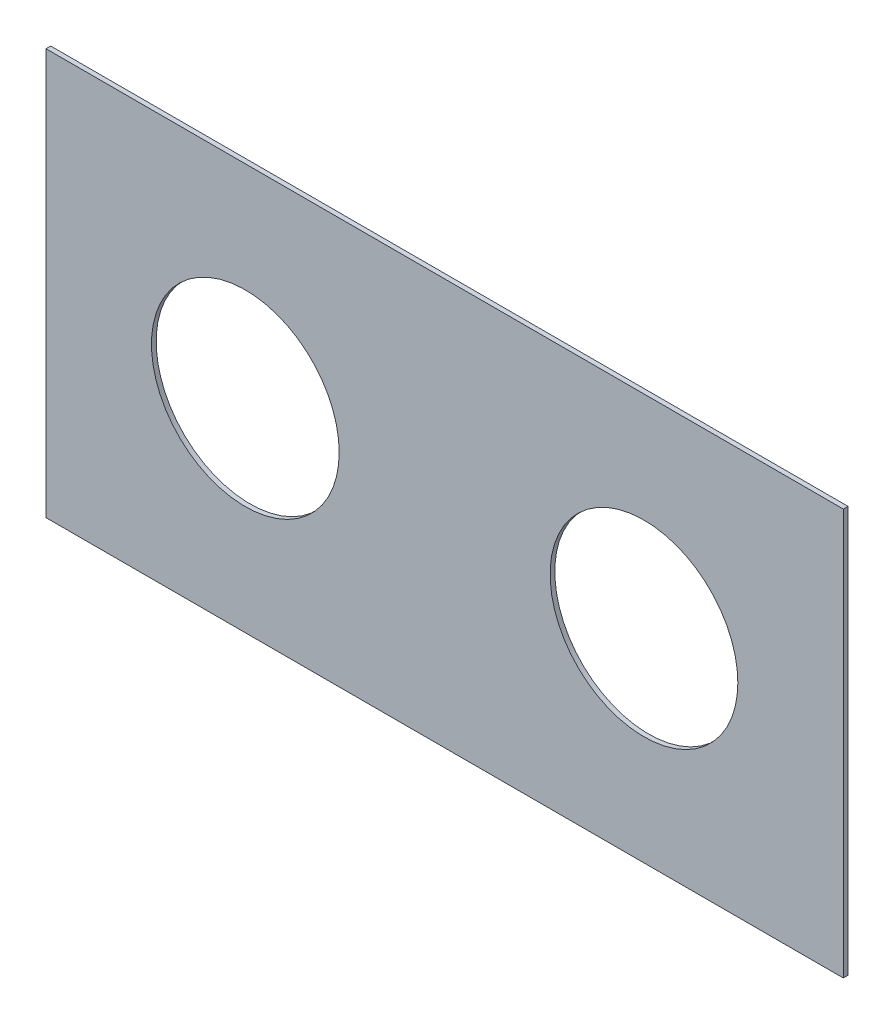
SolidWorks part; units mm, degrees
ref_plane "Plan de face" through (0, 0, 0) normal (0, 0, 1) x (1, 0, 0)
ref_plane "Plan de dessus" through (0, 0, 0) normal (0, 1, 0) x (1, 0, 0)
ref_plane "Plan de droite" through (0, 0, 0) normal (1, 0, 0) x (0, 0, -1)
sketch "Esquisse1" plane through (0, 0, 0) normal (0, 0, 1) x (1, 0, 0)
  line L0 (0, 0) -> (254.8, 0) construction
  line L1 (-254.8, -129.8) -> (254.8, -129.8)
  line L2 (-254.8, -129.8) -> (-254.8, 129.8)
  line L3 (-254.8, 129.8) -> (254.8, 129.8)
  line L4 (254.8, -129.8) -> (254.8, 129.8)
  line L5 (-254.8, -129.8) -> (254.8, 129.8) construction
  line L6 (-254.8, 129.8) -> (254.8, -129.8) construction
  line L7 (0, 0) -> (-254.8, 0) construction
  circle A0 centre (-127.4, 0) radius 60
  circle A1 centre (127.4, 0) radius 60
  point P0 (0, 0)
extrude "Boss.-Extru.1" add sketch "Esquisse1" along normal blind 3
equation "\"T1\"= \"RD1@Annotations\""
